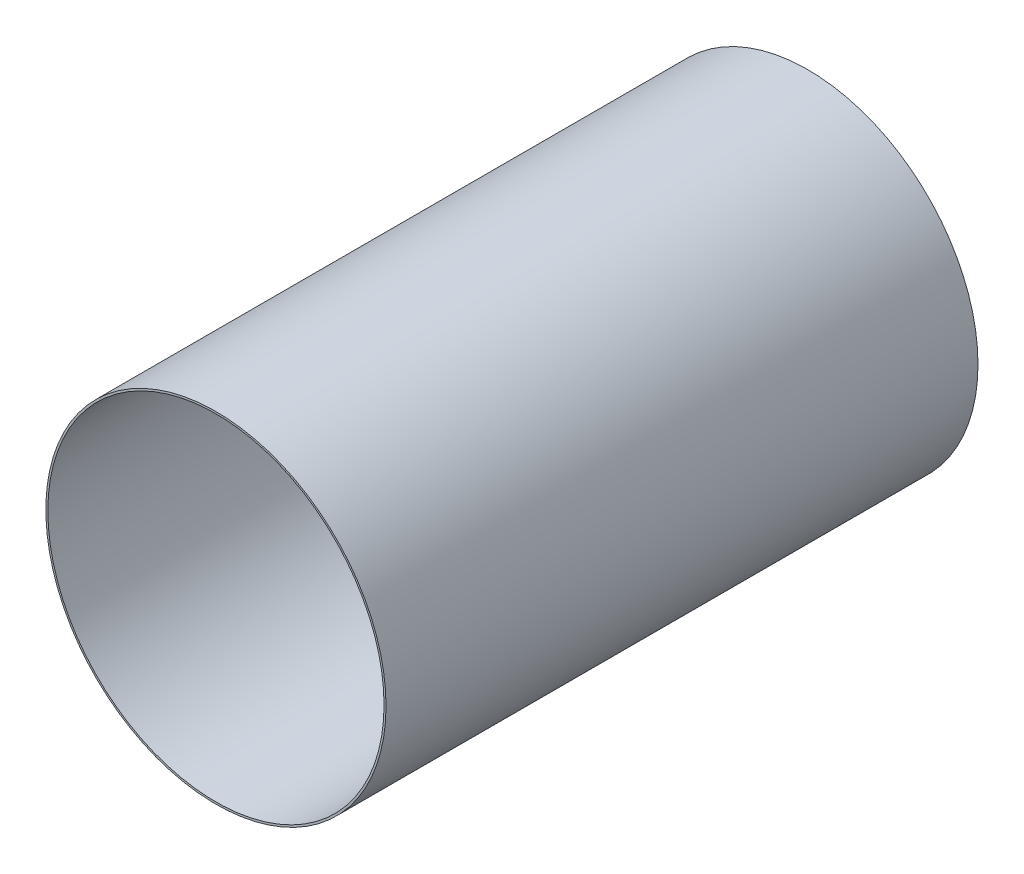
SolidWorks part; units mm, degrees
other "Markup1"
sketch "Sketch3" plane through (-1639.45, -1639.45, 0) normal (0, 0, 1) x (1, 0, 0)
ref_plane "Front Plane" through (0, 0, 0) normal (0, 0, 1) x (1, 0, 0)
ref_plane "Top Plane" through (0, 0, 0) normal (0, 1, 0) x (1, 0, 0)
ref_plane "Right Plane" through (0, 0, 0) normal (1, 0, 0) x (0, 0, -1)
sketch "Sketch1" plane through (0, 0, 0) normal (0, 0, 1) x (1, 0, 0)
  circle A0 centre (0, 0) radius 1723.9
  circle A1 centre (0, 0) radius 1703.9
  dimension "D1" = 3447.8
  dimension "D2" = 20
extrude "Boss-Extrude1" add sketch "Sketch1" along normal mid plane 6000
